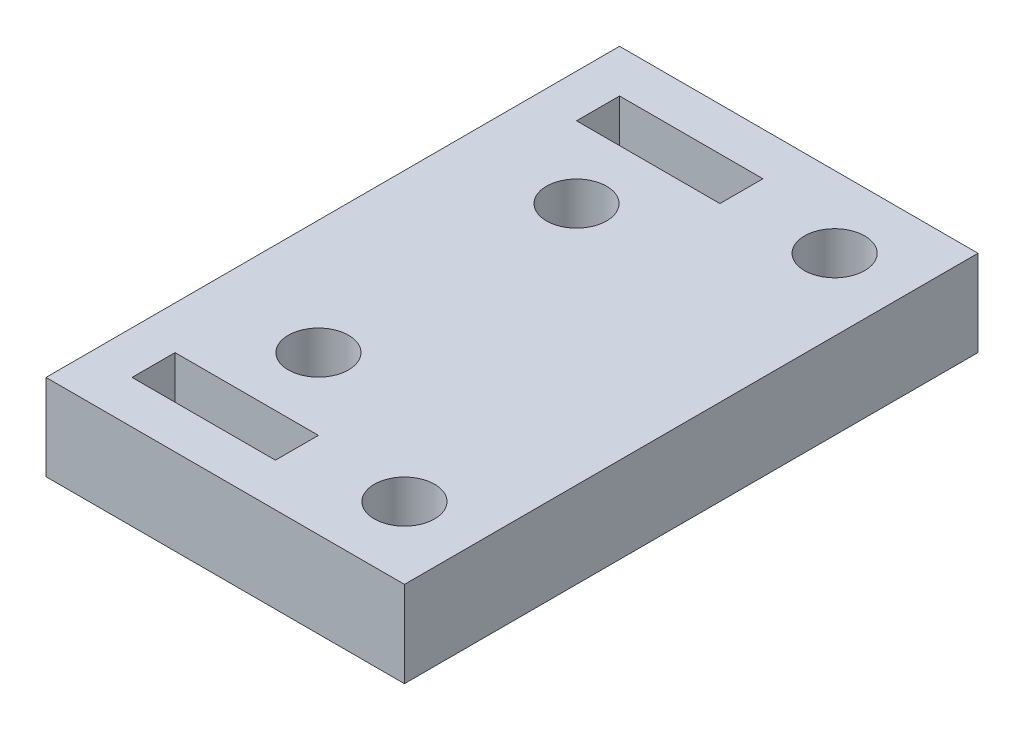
SolidWorks part; units mm, degrees
ref_plane "Спереди" through (0, 0, 0) normal (0, 0, 1) x (1, 0, 0)
ref_plane "Сверху" through (0, 0, 0) normal (0, 1, 0) x (1, 0, 0)
ref_plane "Справа" through (0, 0, 0) normal (1, 0, 0) x (0, 0, -1)
sketch "Эскиз1" plane through (0, 0, 0) normal (0, 1, 0) x (1, 0, 0)
  line L0 (-25, 20) -> (-31.0877, 20) construction
  line L1 (0, 0) -> (-25, 0)
  line L2 (0, 0) -> (0, 40)
  line L3 (0, 40) -> (-25, 40)
  line L4 (-25, 0) -> (-25, 40)
  line L5 (-22, 37) -> (-12, 37)
  line L6 (-22, 37) -> (-22, 34)
  line L7 (-22, 34) -> (-12, 34)
  line L8 (-12, 37) -> (-12, 34)
  line L9 (-12, 3) -> (-12, 6)
  line L10 (-22, 6) -> (-12, 6)
  line L11 (-22, 3) -> (-22, 6)
  line L12 (-22, 3) -> (-12, 3)
  line L13 (0, 0) -> (-25, 0)
  circle A0 centre (-17, 29) radius 2.1
  circle A1 centre (-5, 35) radius 2.1
  circle A2 centre (-5, 5) radius 2.1
  circle A3 centre (-17, 11) radius 2.1
  point P13 (-17, 34)
  point P24 (-17, 6)
  dimension "D8" = 4.2
  dimension "D1" = 25
  dimension "D2" = 40
  dimension "D3" = 10
  dimension "D4" = 3
  dimension "D5" = 3
  dimension "D6" = 3
  dimension "D7" = 5
  dimension "D9" = 5
  dimension "D10" = 5
extrude "Бобышка-Вытянуть1" add sketch "Эскиз1" along normal blind 6 contours L4 L1 L2 L3 A2 A1 A0 L12 L11 L10 L9 L5 L8 L7 L6 A3
